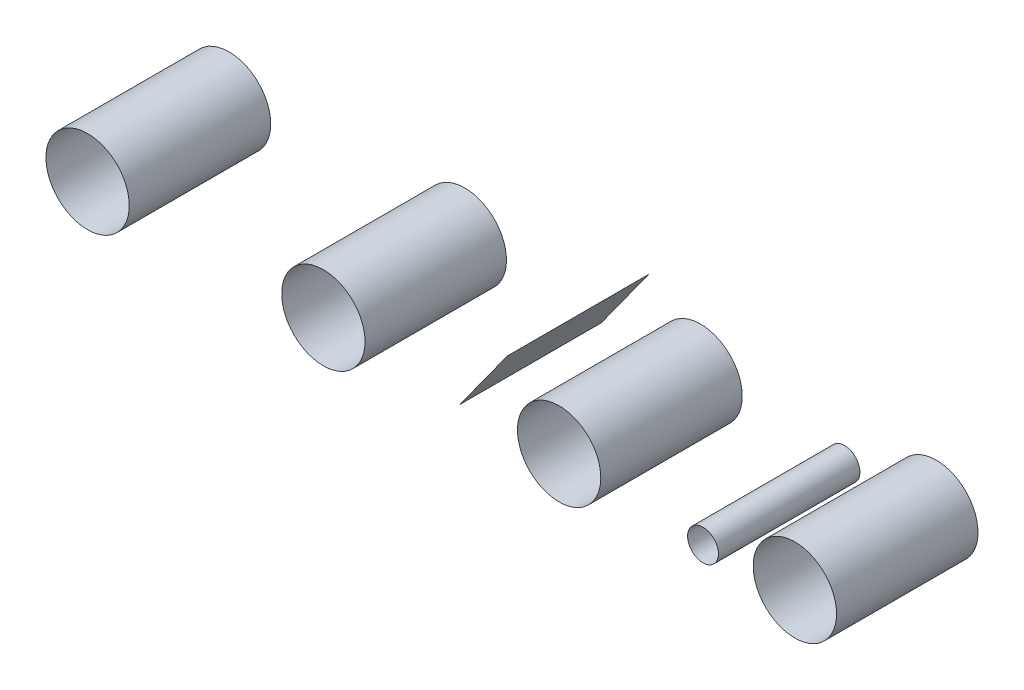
SolidWorks part; units mm, degrees
ref_plane "Front Plane" through (0, 0, 0) normal (0, 0, 1) x (1, 0, 0)
ref_plane "Top Plane" through (0, 0, 0) normal (0, 1, 0) x (1, 0, 0)
ref_plane "Right Plane" through (0, 0, 0) normal (1, 0, 0) x (0, 0, -1)
sketch "Sketch1" plane through (0, 0, 0) normal (0, 0, 1) x (1, 0, 0)
  circle A0 centre (0, 0) radius 35.3467
  circle A1 centre (200, 0) radius 35.3467
  circle A2 centre (400, 0) radius 35.3467
  circle A3 centre (600, 0) radius 35.3467
  dimension "D1" = 4
surface "Surface-Extrude1" sketch "Sketch1" parameters "D1"=120
sketch "Sketch2" plane through (0, 0, 0) normal (0, 1, 0) x (1, 0, 0)
  line L0 (131.6731, -21.4173) -> (131.6731, -87.9061)
  point P0 (55.4779, -56.8456)
sketch "Sketch3" plane through (0, 0, 0) normal (0, 0, 1) x (1, 0, 0)
  line L0 (356.0082, 49.8822) -> (315.7267, -5.9295)
  circle A0 centre (522.0761, -5.9295) radius 13.1015
surface "Surface-Extrude2" sketch "Sketch3" parameters "D1"=120
